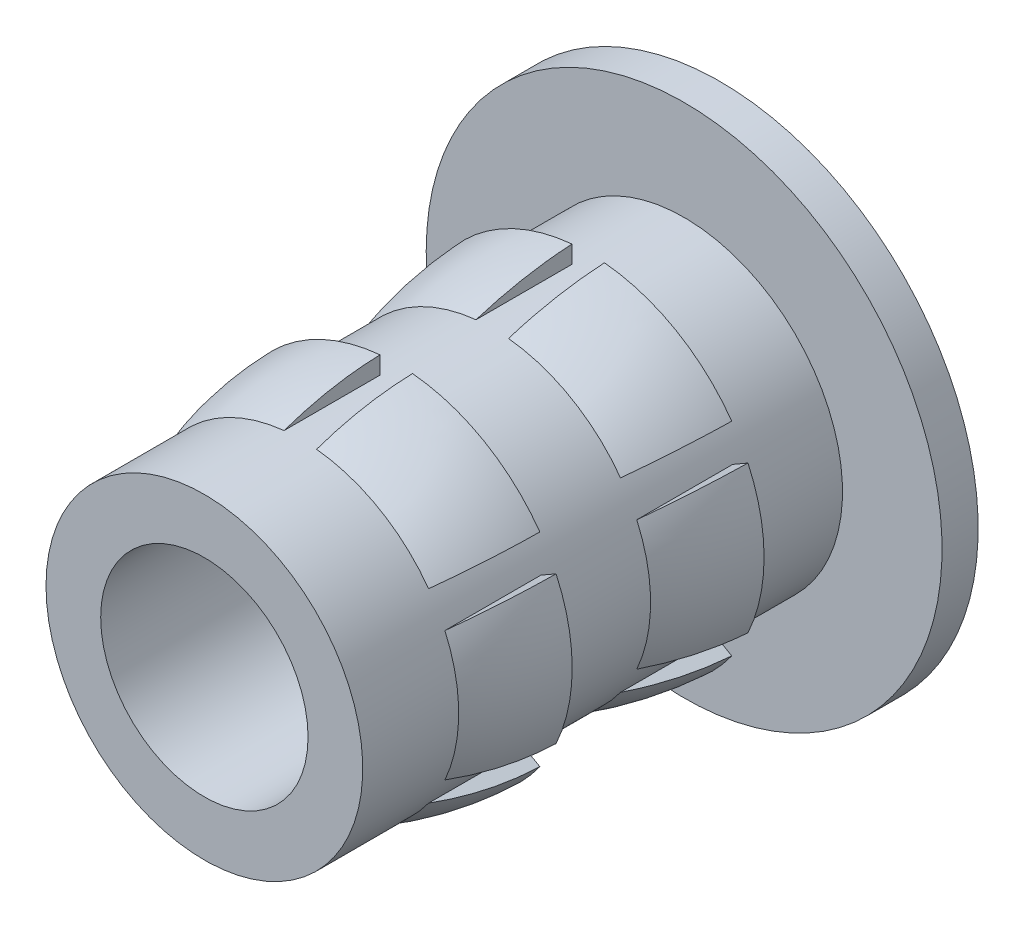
SolidWorks part; units mm, degrees
other "<Flanged insert 1(4)-20>-<1/4-20 Tapped Hole1>"
ref_plane "Front Plane" through (0, 0, 0) normal (0, 0, 1) x (1, 0, 0)
ref_plane "Top Plane" through (0, 0, 0) normal (0, 1, 0) x (1, 0, 0)
ref_plane "Right Plane" through (0, 0, 0) normal (1, 0, 0) x (0, 0, -1)
inserted part "Flanged insert 1(4)-20"
